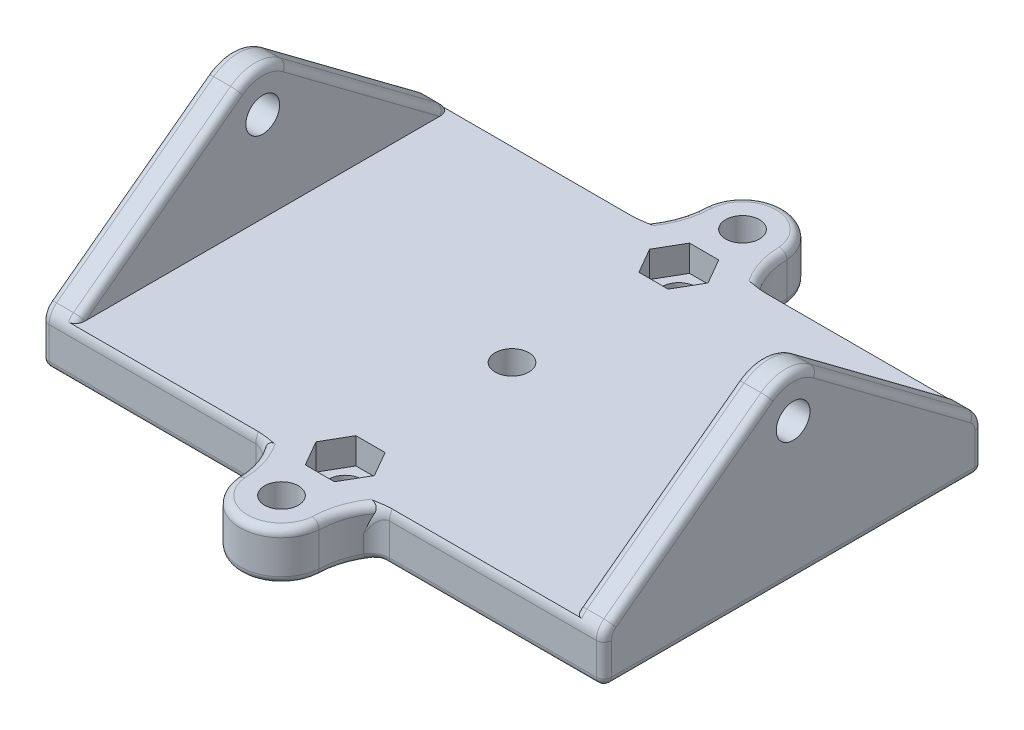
SolidWorks part; units mm, degrees
ref_plane "Front Plane" through (0, 0, 0) normal (0, 0, 1) x (1, 0, 0)
ref_plane "Top Plane" through (0, 0, 0) normal (0, 1, 0) x (1, 0, 0)
ref_plane "Right Plane" through (0, 0, 0) normal (1, 0, 0) x (0, 0, -1)
sketch "Sketch1" plane through (0, 0, 0) normal (0, 1, 0) x (1, 0, 0)
  line L0 (0, 61.5) -> (0, -61.5) construction
  line L1 (-75, 72.5) -> (75, 72.5)
  line L2 (-75, 72.5) -> (-75, -72.5)
  line L3 (-75, -72.5) -> (75, -72.5)
  line L4 (75, 72.5) -> (75, -72.5)
  line L5 (-75, 72.5) -> (75, -72.5) construction
  line L6 (-75, -72.5) -> (75, 72.5) construction
  line L7 (-75, 50.5) -> (75, 50.5)
  line L8 (-75, -50.5) -> (75, -50.5)
  line L9 (-75, 0) -> (75, 0) construction
  line L10 (-75, 30) -> (0, 50.5)
  line L11 (75, 30) -> (0, 50.5)
  line L12 (-75, -30) -> (0, -50.5)
  line L13 (75, -30) -> (0, -50.5)
  line L14 (-75, 61.5) -> (75, 61.5) construction
  circle A0 centre (0, 61.5) radius 4.5
  circle A1 centre (0, -61.5) radius 4.5
  circle A2 centre (0, 0) radius 4.5
  circle A3 centre (0, 61.5) radius 11
  circle A4 centre (0, -61.5) radius 11
  circle A5 centre (-30.9595, 62.7714) radius 20
  circle A6 centre (30.9595, 62.7714) radius 20
  circle A7 centre (30.9595, -62.7714) radius 20
  circle A8 centre (-30.9595, -62.7714) radius 20
  point P0 (0, 0)
  point P17 (0, 50.5)
  point P20 (0, -50.5)
  point P27 (0, 0)
  point P29 (-11, 61.5)
  point P36 (0, 61.5)
  dimension "D3" = 9
  dimension "D4" = 9
  dimension "D5" = 123
  dimension "D6" = 60
  dimension "D7" = 9
  dimension "D8" = 40
  dimension "D1" = 150
  dimension "D2" = 145
extrude "Main Face" add sketch "Sketch1" against normal blind 13 contours L13 L4 L11 L10 L2 L12 A2 | A4 A1 | A3 A0 | A5 L7 A3 | A5 L10 L7 | L7 A6 A3 | L11 A6 L7 | A7 L13 L8 | A7 L8 A4 | L12 A8 L8 | L8 A8 A4 | A8 L8 | L8 A8 L12 L2 | A5 L7 L2 L10 | A5 L7 | A6 L7 | L7 A6 L11 L4 | A7 L8 L4 L13 | L8 A7
sketch "Sketch2" plane through (75, 0, 0) normal (1, 0, 0) x (0, 0, -1)
  line L3 (0, 19.5) -> (0, 35) construction
  line L4 (50.5, 0) -> (-50.5, 0) construction
  line L5 (50.5, 0) -> (-50.5, 0) construction
  line L6 (0, 0) -> (0, 97.7288) construction
  line L7 (50.5, 0) -> (6.5839, 32.812)
  line L8 (-50.5, 0) -> (-6.5839, 32.812)
  circle A0 centre (0, 24) radius 4.5
  circle A1 centre (0, 24) radius 11
  point P1 (0, 0)
  dimension "D1" = 9
  dimension "D4" = 24
  dimension "D2" = 22
  dimension "D3" = 101
extrude "Arms" add sketch "Sketch2" against normal blind 8.5
mirror "Mirror2" about plane through (0, 0, 0) normal (1, 0, 0) of "Arms"
sketch "Sketch3" plane through (0, 0, 0) normal (0, 1, 0) x (1, 0, 0)
  line L0 (0, 44.5) -> (0, -44.5) construction
  line L1 (3.8971, 37.75) -> (7.7942, 44.5)
  line L2 (7.7942, 44.5) -> (3.8971, 51.25)
  line L3 (3.8971, 51.25) -> (-3.8971, 51.25)
  line L4 (-3.8971, 51.25) -> (-7.7942, 44.5)
  line L5 (-7.7942, 44.5) -> (-3.8971, 37.75)
  line L6 (-3.8971, 37.75) -> (3.8971, 37.75)
  line L7 (7.7942, -44.5) -> (3.8971, -37.75)
  line L8 (3.8971, -37.75) -> (-3.8971, -37.75)
  line L9 (-3.8971, -37.75) -> (-7.7942, -44.5)
  line L10 (-7.7942, -44.5) -> (-3.8971, -51.25)
  line L11 (-3.8971, -51.25) -> (3.8971, -51.25)
  line L12 (3.8971, -51.25) -> (7.7942, -44.5)
  circle A0 centre (0, 44.5) radius 6.75 construction
  circle A1 centre (0, -44.5) radius 6.75 construction
  dimension "D1" = 13.5
  dimension "D2" = 89
extrude "Captive Nuts" cut sketch "Sketch3" against normal blind 7
sketch "Sketch4" plane through (0, 0, 0) normal (0, 1, 0) x (1, 0, 0)
  line L0 (0, 44.5) -> (0, -44.5) construction
  circle A0 centre (0, 44.5) radius 4.5
  circle A1 centre (0, -44.5) radius 4.5
  dimension "D1" = 9
  dimension "D2" = 89
extrude "Cut-Extrude2" cut sketch "Sketch4" against normal up to next
fillet "Fillet1" radius 2 17 edges at (0, -13, -57) (0, -13, 4.5) (0, -13, 66) (0, -13, -72.5) (-12.1013, -13, -56.1106) (-45.0834, -13, -50.5) (-75, -13, 0) (-45.0834, -13, 50.5) (-12.1013, -13, 56.1106) (0, -13, 72.5) (12.1013, -13, 56.1106) (45.0834, -13, 50.5) (75, -13, 0) (45.0834, -13, -50.5) (12.1013, -13, -56.1106) (0, -13, 49) (0, -13, -40)
fillet "Fillet3" radius 5 8 edges at (14.9878, -12.1557, 50.1323) (-14.9878, -12.1557, 50.1323) (14.9878, -12.1557, -50.1323) (-14.9878, -12.1557, -50.1323) (15.1667, -5.5, 50.5) (-15.1667, -5.5, 50.5) (15.1667, -5.5, -50.5) (-15.1667, -5.5, -50.5)
fillet "Fillet4" radius 5 4 edges at (-70.75, 0, 50.5) (-70.75, 0, -50.5)
fillet "Fillet5" radius 2 6 edges at (12.209, 0, -55.8133) (0, 0, -72.5) (-12.209, 0, -55.8133) (12.209, 0, 55.8133) (-12.209, 0, 55.8133) (0, 0, 72.5)
fillet "Fillet6" radius 2 28 edges at (-74.4142, -12.4142, -49.9142) (-75, -6.7529, -50.5) (-75, -0.2656, -49.9701) (-74.4142, -12.4142, 49.9142) (-75, -6.7529, 50.5) (-75, -0.2656, 49.9701) (-75, 17.1559, 27.5383) (-66.5, 17.1559, 27.5383) (-75, 35, 0) (-66.5, 35, 0) (74.4142, -12.4142, -49.9142) (75, -6.7529, -50.5) (75, -0.2656, -49.9701) (74.4142, -12.4142, 49.9142) (75, -6.7529, 50.5) (75, -0.2656, 49.9701) (75, 17.1559, 27.5383) (75, 35, 0) (66.5, 35, 0) (66.5, 0.8175, -49.2358) (66.5, 0.8175, 49.2358) (-66.5, 0.8175, 49.2358) (-66.5, 0.8175, -49.2358) (-66.5, 17.1559, -27.5383) (-75, 17.1559, -27.5383) (75, 17.1559, -27.5383)
